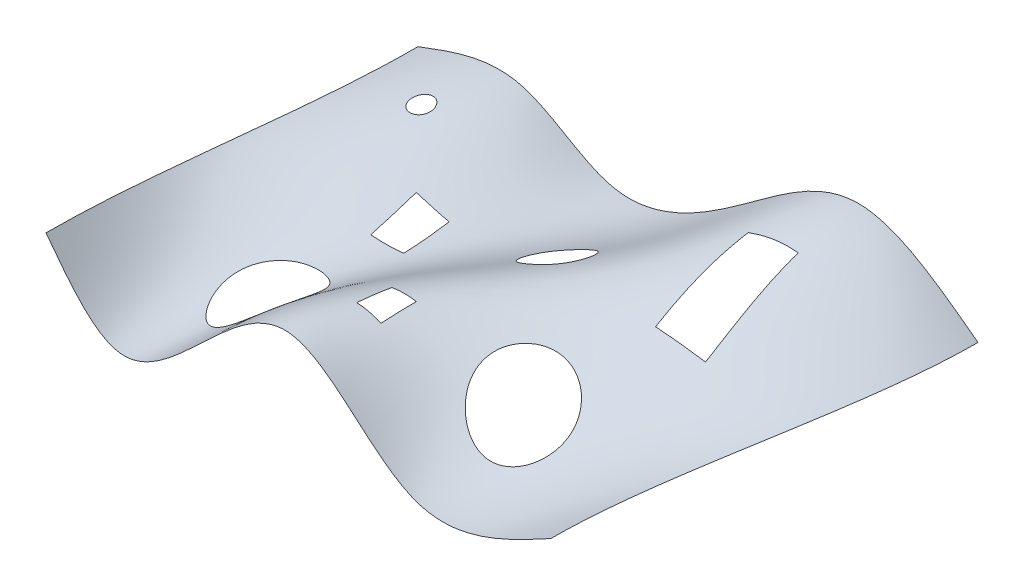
SolidWorks part; units mm, degrees
ref_plane "Front Plane" through (0, 0, 0) normal (0, 0, 1) x (1, 0, 0)
ref_plane "Top Plane" through (0, 0, 0) normal (0, 1, 0) x (1, 0, 0)
ref_plane "Right Plane" through (0, 0, 0) normal (1, 0, 0) x (0, 0, -1)
sketch "Sketch1" plane through (0, 0, 0) normal (0, 0, 1) x (1, 0, 0)
  spline S0 degree 3 poles (-108.2305, 7.6019) (-98.0371, -5.9796) (-68.5188, -45.3095) (-12.1021, 57.3355) (42.091, -30.2278) (83.2298, -7.9979) (102.5613, 2.4481) knots 0 0 0 0 0.171618 0.496981 0.763628 1 1 1 1
ref_plane "Plane1" through (0, 0, -146.0287) normal (0, 0, 1) x (1, 0, 0)
sketch "Sketch2" plane through (0, 0, -146.0287) normal (0, 0, 1) x (1, 0, 0)
  spline S0 degree 3 poles (-98.9275, 6.5704) (-84.4387, 12.0591) (-55.5275, 23.0112) (-17.4134, -13.5152) (34.3306, 11.5515) (81.2336, 56.8284) (117.9981, 29.2182) (134.8998, 16.525) knots 0 0 0 0 0.169427 0.338077 0.520221 0.779431 1 1 1 1
surface "Surface-Loft1"
sketch "Sketch3" plane through (0, 0, 0) normal (0, 1, 0) x (1, 0, 0)
  line L1 (-50.7331, 97.1277) -> (-37.0043, 97.1277)
  line L2 (-50.7331, 97.1277) -> (-50.7331, 78.1186)
  line L3 (-50.7331, 78.1186) -> (-37.0043, 78.1186)
  line L4 (-37.0043, 97.1277) -> (-37.0043, 78.1186)
  line L5 (64.9953, 120.0091) -> (85.8509, 120.0091)
  line L6 (64.9953, 120.0091) -> (64.9953, 81.2868)
  line L7 (64.9953, 81.2868) -> (85.8509, 81.2868)
  line L8 (85.8509, 120.0091) -> (85.8509, 81.2868)
  line L9 (-4.6184, 40.8044) -> (5.5902, 40.8044)
  line L10 (-4.6184, 40.8044) -> (-4.6184, 26.106)
  line L11 (-4.6184, 26.106) -> (5.5902, 26.106)
  line L12 (5.5902, 40.8044) -> (5.5902, 26.106)
  circle A0 centre (-71.5023, 120.0091) radius 4.5763
  circle A1 centre (-56.3654, 40.8044) radius 18.3051
  circle A2 centre (8.0544, 97.1277) radius 12.1383
  circle A3 centre (47.8327, 43.2686) radius 17.1626
surface "Surface-Trim1"
